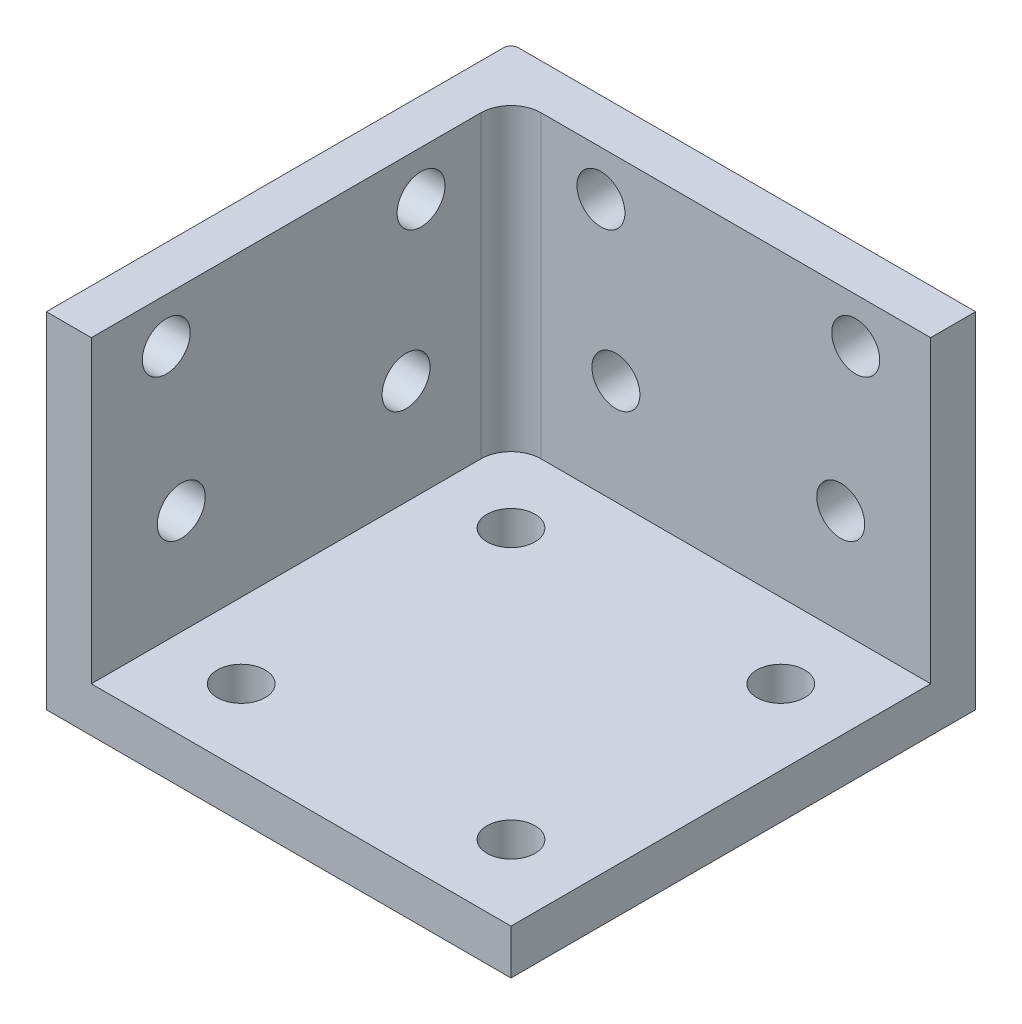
SolidWorks part; units mm, degrees
ref_plane "前视基准面" through (0, 0, 0) normal (0, 0, 1) x (1, 0, 0)
ref_plane "上视基准面" through (0, 0, 0) normal (0, 1, 0) x (1, 0, 0)
ref_plane "右视基准面" through (0, 0, 0) normal (1, 0, 0) x (0, 0, -1)
sketch "草图1" plane through (0, 0, 0) normal (0, 0, 1) x (1, 0, 0)
  line L0 (0, 0) -> (0, 23)
  line L1 (0, 0) -> (31, 0)
  line L2 (3, 3) -> (31, 3)
  line L3 (3, 3) -> (3, 23)
  line L4 (0, 23) -> (3, 23)
  line L5 (31, 3) -> (31, 0)
  dimension "D1" = 3
  dimension "D2" = 28
extrude "凸台-拉伸1" add sketch "草图1" along normal blind 28
sketch "草图2" plane through (3, 0, 0) normal (1, 0, 0) x (0, 0, -1)
  line L0 (-28, 23) -> (0, 23) construction
  line L1 (-28, 3) -> (-28, 23) construction
  circle A0 centre (-23, 20) radius 1.6
  circle A1 centre (-6, 20) radius 1.6
  dimension "D1" = 3
  dimension "D2" = 5
  dimension "D3" = 17
  dimension "D4" = 3
  dimension "D5" = 3.2
  dimension "D6" = 3.2
extrude "切除-拉伸1" cut sketch "草图2" against normal blind 10
sketch "草图3" plane through (3, 0, 0) normal (1, 0, 0) x (0, 0, -1)
  line L0 (-28, 3) -> (-28, 23) construction
  line L2 (-28, 3) -> (0, 3) construction
  circle A0 centre (-22, 10) radius 1.6
  circle A1 centre (-7, 10) radius 1.6
  dimension "D1" = 6
  dimension "D2" = 15
  dimension "D3" = 7
  dimension "D4" = 7
  dimension "D5" = 3.2
  dimension "D6" = 3.2
extrude "切除-拉伸2" cut sketch "草图3" against normal blind 10
sketch "草图5" plane through (0, 3, 0) normal (0, 1, 0) x (1, 0, 0)
  line L0 (31, -28) -> (3, -28) construction
  line L1 (31, 0) -> (3, 0) construction
  line L2 (31, -28) -> (31, 0) construction
  line L3 (3, -28) -> (3, 0) construction
  circle A0 centre (26, -23) radius 1.6
  circle A1 centre (26, -5) radius 1.6
  circle A2 centre (8, -23) radius 1.6
  circle A3 centre (8, -5) radius 1.6
  dimension "D1" = 5
  dimension "D2" = 5
  dimension "D3" = 5
  dimension "D4" = 5
  dimension "D5" = 3.2
  dimension "D6" = 5
  dimension "D7" = 5
  dimension "D8" = 5
  dimension "D9" = 5
extrude "切除-拉伸3" cut sketch "草图5" against normal blind 10
sketch "草图6" plane through (0, 0, 0) normal (0, 0, -1) x (-1, 0, 0)
  line L0 (-3, 23) -> (0, 23) construction
  line L1 (0, 0) -> (-31, 0)
  line L2 (0, 0) -> (0, 23)
  line L3 (0, 23) -> (-31, 23)
  line L4 (-31, 0) -> (-31, 23)
  line L5 (-31, 0) -> (-31, 3) construction
extrude "凸台-拉伸2" add sketch "草图6" along normal blind 3
sketch "草图7" plane through (0, 0, 0) normal (0, 0, 1) x (1, 0, 0)
  line L1 (3, 23) -> (31, 23) construction
  line L2 (31, 23) -> (31, 3) construction
  circle A0 centre (26, 20) radius 1.6
  circle A1 centre (9, 20) radius 1.6
  circle A2 centre (25, 10) radius 1.6
  circle A3 centre (10, 10) radius 1.6
  dimension "D1" = 3.2
  dimension "D4" = 3.2
  dimension "D7" = 3.2
  dimension "D10" = 3.2
  dimension "D2" = 3
  dimension "D3" = 5
  dimension "D5" = 3
  dimension "D6" = 17
  dimension "D8" = 6
  dimension "D9" = 10
  dimension "D11" = 15
  dimension "D12" = 10
extrude "切除-拉伸4" cut sketch "草图7" against normal blind 3
fillet "圆角1" radius 2 1 edges
fillet "圆角3" radius 0.5 1 edges at (0, 11.5, -3)
